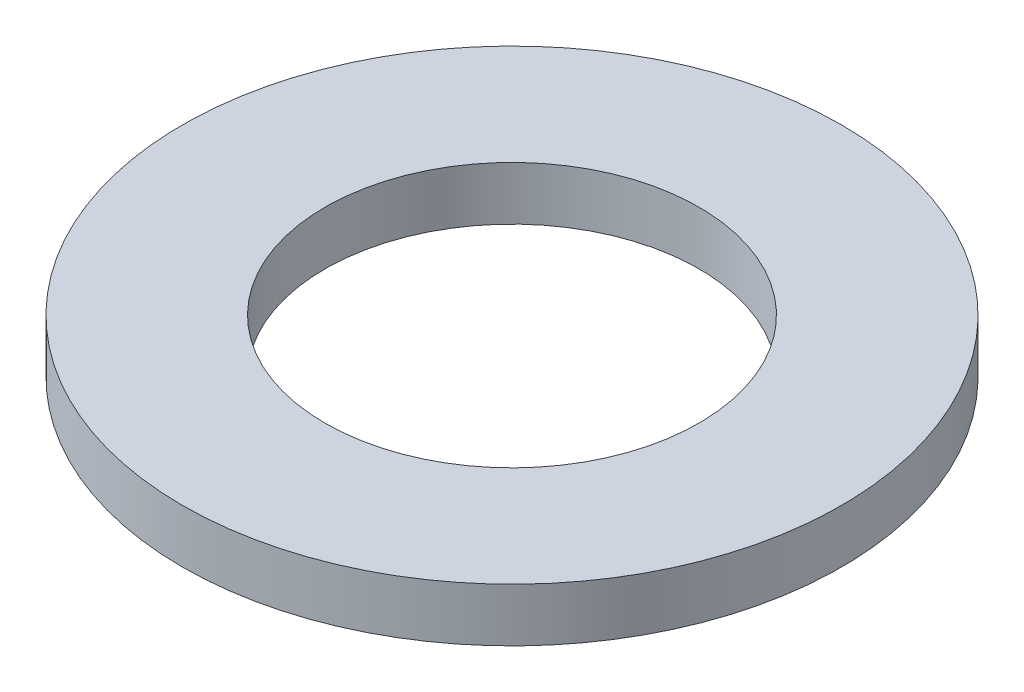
SolidWorks part; units mm, degrees
ref_plane "Front" through (0, 0, 0) normal (0, 0, 1) x (1, 0, 0)
ref_plane "Top" through (0, 0, 0) normal (0, 1, 0) x (1, 0, 0)
ref_plane "Right" through (0, 0, 0) normal (1, 0, 0) x (0, 0, -1)
sketch "Sketch1" plane through (0, 0, 0) normal (0, 1, 0) x (1, 0, 0)
  circle A0 centre (0, 0) radius 10.5
  circle A1 centre (0, 0) radius 18.5
extrude "Extrude1" add sketch "Sketch1" along normal blind 3
